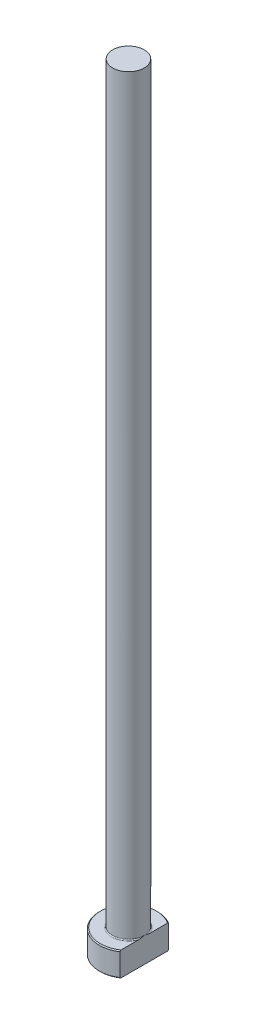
SolidWorks part; units mm, degrees
ref_plane "Front Plane" through (0, 0, 0) normal (0, 0, 1) x (1, 0, 0)
ref_plane "Top Plane" through (0, 0, 0) normal (0, 1, 0) x (1, 0, 0)
ref_plane "Right Plane" through (0, 0, 0) normal (1, 0, 0) x (0, 0, -1)
sketch "Sketch1" plane through (0, 0, 0) normal (0, 0, 1) x (1, 0, 0)
  line L0 (0, 259.9588) -> (0, -15.1925) construction
  line L1 (0, 0) -> (-6, 0)
  line L2 (-6, 0) -> (-6, 5)
  line L3 (-6, 5) -> (-3.25, 5)
  line L4 (-3.25, 5) -> (-3.25, 160)
  line L5 (-3.25, 160) -> (0, 160)
  line L6 (0, 160) -> (0, 0)
  dimension "L" = 160
  dimension "H" = 12
  dimension "T" = 5
  dimension "D" = 6.5
revolve "Revolve1" add sketch "Sketch1" angle 360 about L0
chamfer "Chamfer1" distance 0.2 angle 45 2 edges at (0, 5, 6) (0, 0, 6)
fillet "Fillet1" radius 0.2 1 edges at (0, 5, 3.25)
sketch "Sketch2" plane through (0, 0, 0) normal (0, 1, 0) x (1, 0, 0)
  line L0 (3.25, 5.0436) -> (3.25, -5.0436)
  circle A0 centre (0, 0) radius 6 construction
  arc A1 (3.25, -5.0436) -> (3.25, 5.0436) centre (0, 0) ccw
  circle A2 centre (0, 0) radius 3.25 construction
extrude "KEY" cut sketch "Sketch2" along normal through all
